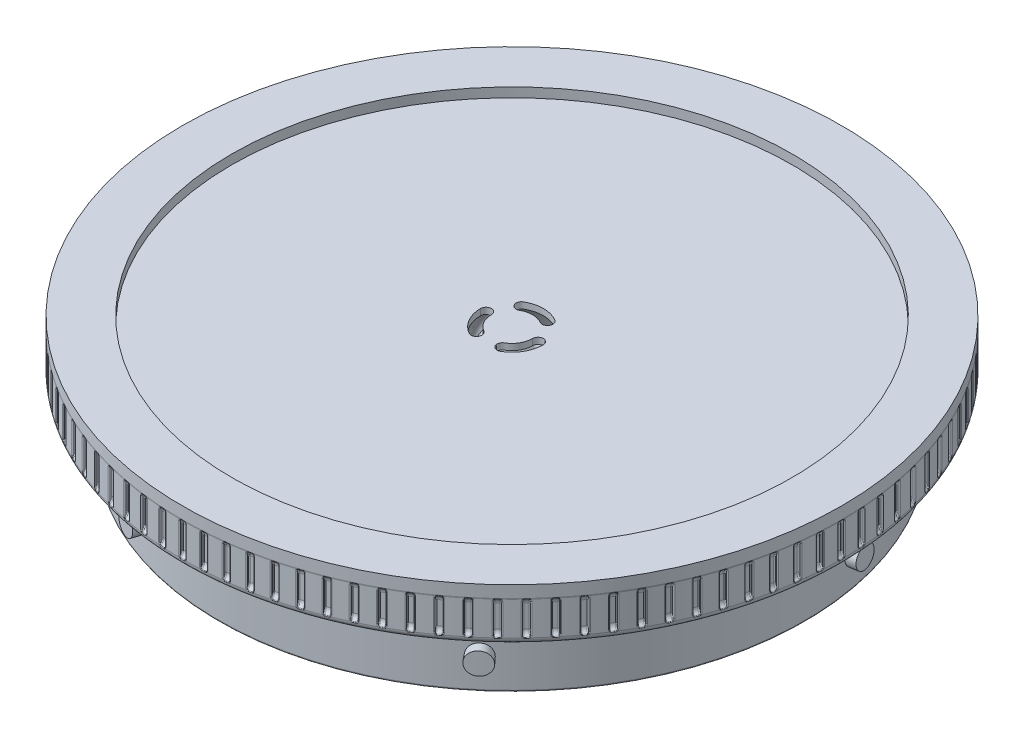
SolidWorks part; units mm, degrees
ref_plane "Front Plane" through (0, 0, 0) normal (0, 0, 1) x (1, 0, 0)
ref_plane "Top Plane" through (0, 0, 0) normal (0, 1, 0) x (1, 0, 0)
ref_plane "Right Plane" through (0, 0, 0) normal (1, 0, 0) x (0, 0, -1)
sketch "Sketch1" plane through (0, 0, 0) normal (0, 0, 1) x (1, 0, 0)
  line L7 (0, 26.2758) -> (0, -19.9258) construction
  line L11 (-38.4313, 0) -> (44.5982, 0) construction
  line L18 (-21.0799, 0.127) -> (-21.0799, 3.556)
  line L19 (-20.5719, 4.064) -> (-1.905, 4.064)
  line L27 (-21.5736, 0) -> (-21.2069, 0)
  line L30 (-23.8125, 6.0452) -> (-26.162, 6.0452)
  line L32 (-22.684, 9.017) -> (0, 9.017)
  line L35 (-22.684, 9.017) -> (-22.684, 9.779)
  line L36 (-22.684, 9.779) -> (-26.162, 9.779)
  line L37 (-26.67, 9.271) -> (-26.67, 6.5532)
  line L38 (0, 3.9624) -> (0, 9.017)
  line L40 (0, 3.9624) -> (-1.905, 3.9624)
  line L41 (-1.905, 3.9624) -> (-1.905, 4.064)
  line L43 (-21.7001, 0.1159) -> (-21.7297, 0.4539)
  line L44 (-21.9827, 0.6858) -> (-23.6093, 0.6858)
  line L45 (-23.7363, 0.8128) -> (-23.7363, 5.969)
  line L46 (-21.8111, 0.6858) -> (-21.8111, 0) construction
  arc A3 (-23.7363, 5.969) -> (-23.8125, 6.0452) centre (-23.8125, 5.969) ccw
  arc A4 (-26.162, 6.0452) -> (-26.67, 6.5532) centre (-26.162, 6.5532) cw
  arc A5 (-21.0799, 0.127) -> (-21.2069, 0) centre (-21.2069, 0.127) cw
  arc A6 (-21.5736, 0) -> (-21.7001, 0.1159) centre (-21.5736, 0.127) cw
  arc A8 (-26.162, 9.779) -> (-26.67, 9.271) centre (-26.162, 9.271) ccw
  arc A9 (-23.6093, 0.6858) -> (-23.7363, 0.8128) centre (-23.6093, 0.8128) cw
  arc A10 (-21.7297, 0.4539) -> (-21.9827, 0.6858) centre (-21.9827, 0.4318) ccw
  arc A11 (-21.0799, 3.556) -> (-20.5719, 4.064) centre (-20.5719, 3.556) cw
  point P18 (-21.3903, 0)
  point P22 (-21.0799, 4.064)
  point P25 (-21.7149, 0.2849)
  point P36 (-21.0799, 0)
  point P39 (-11.2385, 4.064)
  point P40 (-21.8111, 0.6191)
  point P45 (-26.67, 9.779)
  dimension "D8" = 47.4726
  dimension "D18" = 0.508
  dimension "D19" = 0.508
  dimension "D20" = 0.127
  dimension "D3" = 0.0762
  dimension "D13" = 5
  dimension "D17" = 0.127
  dimension "D21" = 0.254
  dimension "D22" = 0.127
  dimension "D23" = 0.508
  dimension "D4" = 4.064
  dimension "D5" = 4.953
  dimension "D6" = 0.6858
  dimension "D7" = 0.635
  dimension "D9" = 3.81
  dimension "D10" = 0.1016
  dimension "D11" = 53.34
  dimension "D12" = 0.762
  dimension "D14" = 2.0066
  dimension "D15" = 45.368
  dimension "D16" = 6.0452
revolve "Revolve1" add sketch "Sketch1" angle 360 about L7
sketch "Sketch6" plane through (0, 0, 0) normal (0, 0, 1) x (1, 0, 0)
  line L0 (0, 14.0933) -> (0, -17.2671) construction
  line L1 (-1.1303, 5.207) -> (-1.524, 5.207)
  line L2 (-1.905, 3.9624) -> (1.905, 3.9624) construction
  line L3 (-1.524, 5.207) -> (-1.524, 7.366)
  line L4 (-1.143, 7.747) -> (0, 7.747)
  line L7 (-1.1303, 4.3815) -> (-1.1303, 5.207)
  line L8 (-1.2954, 4.2164) -> (-1.1303, 4.3815)
  line L9 (-1.2954, 3.9624) -> (-1.2954, 4.2164)
  line L10 (0, 3.9624) -> (0, 7.747)
  line L11 (22.684, 9.017) -> (-22.684, 9.017) construction
  line L13 (-1.2954, 3.9624) -> (0, 3.9624)
  arc A0 (-1.524, 7.366) -> (-1.143, 7.747) centre (-1.143, 7.366) cw
  dimension "D8" = 0.381
  dimension "D1" = 0.254
  dimension "D2" = 2.5908
  dimension "D3" = 2.2606
  dimension "D4" = 1.2446
  dimension "D5" = 135
  dimension "D6" = 3.048
  dimension "D7" = 1.27
revolve "Cut-Revolve1" cut sketch "Sketch6" angle 360 about L0
fillet "Fillet2" radius 0.1524 1 edges at (0, 3.9624, 1.2954)
sketch "Sketch17" plane through (0, 0, 0) normal (0, 0, 1) x (1, 0, 0)
  line L0 (0, 21.9284) -> (0, -19.7948) construction
  line L1 (-12.7, 1.0668) -> (12.7, 1.0668) construction
  line L2 (-23.6093, 0.6858) -> (23.6093, 0.6858) construction
  text T0 "SP007FL" font "Century Gothic" height in points 6
  point P5 (0, 1.0668)
  dimension "D1" = 0.381
  dimension "D2" = 12.7
wrap "Wrap6" sketch "Sketch17" wrap type deboss source sketch "Sketch17" thickness 0.508 parameters "D1"=0.508
sketch "Sketch9" plane through (0, 0, 0) normal (0, 0, 1) x (1, 0, 0)
  line L3 (26.67, 9.271) -> (26.67, 6.5532)
  line L4 (0, 21.7779) -> (0, -14.6441) construction
  line L5 (-26.67, 6.5532) -> (26.67, 6.5532) construction
  line L6 (-26.67, 9.271) -> (26.67, 9.271) construction
  line L7 (26.416, 8.8311) -> (26.416, 6.9931)
  arc A2 (26.416, 6.9931) -> (26.67, 6.5532) centre (26.924, 6.9931) ccw
  arc A3 (26.67, 9.271) -> (26.416, 8.8311) centre (26.924, 8.8311) ccw
  dimension "D1" = 0.254
revolve "Knurls" cut sketch "Sketch9" angle 1 mid plane about L4
sketch "Sketch11" plane through (0, 9.017, 0) normal (0, 1, 0) x (1, 0, 0)
  circle A0 centre (0, 0) radius 22.684
  circle A1 centre (0, 0) radius 22.684 construction
sketch "Sketch12" plane through (0, 9.779, 0) normal (0, 1, 0) x (1, 0, 0)
  circle A0 centre (0, 0) radius 26.67
  circle A1 centre (0, 0) radius 26.67 construction
  circle A2 centre (0, 0) radius 22.684
  circle A3 centre (0, 0) radius 22.684 construction
fillet "Fillet - Knurl" radius 0.0762 10 edges at (26.669, 7.9121, 0.2327) (26.669, 7.9121, -0.2327) (26.415, 7.9121, 0.2305) (26.415, 7.9121, -0.2305) (26.4831, 9.0851, 0.2311) (26.4831, 9.0851, -0.2311) (26.4831, 6.7391, 0.2311) (26.4831, 6.7391, -0.2311) (26.67, 6.5532, 0) (26.67, 9.271, 0)
pattern_circular "CirPattern2" count 100 over 360 about axis through (0, 6.5532, 0) along (0, 1, 0) of "Knurls", "Fillet - Knurl"
sketch "Sketch4" plane through (0, 4.064, 0) normal (0, 1, 0) x (1, 0, 0)
  line L0 (0, 7.9602) -> (0, -9.8695) construction
  line L1 (-13.1456, 0) -> (14.4693, 0) construction
  line L2 (0, 0) -> (1.858, -3.2182) construction
  line L3 (0, 0) -> (-1.858, -3.2182) construction
  arc A1 (4.1529, 0) -> (3.2791, 0) centre (3.716, 0) ccw construction
  arc A2 (1.6396, -2.8398) -> (2.0764, -3.5965) centre (1.858, -3.2182) ccw construction
  arc A3 (4.1529, 0) -> (2.0764, -3.5965) centre (0, 0) cw construction
  arc A4 (3.2791, 0) -> (1.6396, -2.8398) centre (0, 0) cw construction
  arc A5 (-2.0765, -3.5965) -> (-1.6396, -2.8398) centre (-1.858, -3.2182) ccw
  arc A6 (-1.6396, -2.8398) -> (-3.2791, 0) centre (0, 0) cw
  arc A7 (-3.2791, 0) -> (-4.1529, 0) centre (-3.716, 0) ccw
  arc A8 (-2.0765, -3.5965) -> (-4.1529, 0) centre (0, 0) cw
  arc A9 (-2.0764, 3.5965) -> (-1.6396, 2.8398) centre (-1.858, 3.2182) ccw construction
  arc A10 (-1.6396, 2.8398) -> (1.6396, 2.8398) centre (0, 0) cw construction
  arc A11 (1.6396, 2.8398) -> (2.0765, 3.5965) centre (1.858, 3.2182) ccw construction
  arc A12 (-2.0764, 3.5965) -> (2.0765, 3.5965) centre (0, 0) cw construction
  circle A15 centre (0, 0) radius 4.1529 construction
  circle A16 centre (0, 0) radius 1.905 construction
  point P31 (0, 0)
  dimension "D1" = 8.3058
  dimension "D3" = 0.4369
  dimension "D2" = 60
  dimension "D4" = 60
sketch "Sketch14" plane through (0, 9.017, 0) normal (0, 1, 0) x (1, 0, 0)
  line L0 (0, 0) -> (-2.54, 0) construction
  line L1 (0, 0) -> (-1.27, -2.1997) construction
  arc A1 (-1.27, 2.1997) -> (-0.8331, 1.443) centre (-1.0516, 1.8214) ccw construction
  arc A2 (0.8331, 1.443) -> (-0.8331, 1.443) centre (0, 0) ccw construction
  arc A3 (0.8331, 1.443) -> (1.27, 2.1997) centre (1.0516, 1.8214) ccw construction
  arc A4 (1.27, 2.1997) -> (-1.27, 2.1997) centre (0, 0) ccw construction
  arc A5 (2.54, 0) -> (1.6662, 0) centre (2.1031, 0) ccw construction
  arc A6 (0.8331, -1.443) -> (1.6662, 0) centre (0, 0) ccw construction
  arc A7 (0.8331, -1.443) -> (1.27, -2.1997) centre (1.0516, -1.8214) ccw construction
  arc A8 (1.27, -2.1997) -> (2.54, 0) centre (0, 0) ccw construction
  circle A9 centre (0, 0) radius 2.54 construction
  arc A24 (-1.27, -2.1997) -> (-0.8331, -1.443) centre (-1.0516, -1.8214) ccw
  arc A25 (-2.54, 0) -> (-1.27, -2.1997) centre (0, 0) ccw
  arc A26 (-1.6662, 0) -> (-2.54, 0) centre (-2.1031, 0) ccw
  arc A27 (-1.6662, 0) -> (-0.8331, -1.443) centre (0, 0) ccw
  point P17 (0, 0)
  point P19 (0, 0)
  dimension "D1" = 0.8738
  dimension "D2" = 60
  dimension "D4" = 5.08
  dimension "D3" = 3
sketch "Sketch15" plane through (0, 0, 0) normal (0, 0, 1) x (1, 0, 0)
  arc A0 (-2.54, 9.017) -> (-4.1529, 4.064) centre (4.2586, 4.064) ccw
loft "Cut-Loft2" cut profiles "Sketch4", "Sketch14"
pattern_circular "CirPattern3" count 3 over 360 about axis through (0, 9.779, 0) along (0, 1, 0) of "Cut-Loft2"
fillet "Fillet9" radius 0.127 8 edges
fillet "Fillet10" radius 0.254 1 edges at (-22.684, 9.779, 0)
sketch "Sketch16" plane through (0, 0, 0) normal (0, 0, 1) x (1, 0, 0)
  circle A0 centre (-7.8994, 3.195) radius 0.889
  point P2 (-7.8994, 2.306)
  point P6 (-7.8994, 4.084)
  dimension "D1" = 1.778
  dimension "D2" = 4.084
  dimension "D3" = 7.8994
wrap "Wrap1" sketch "Sketch16" wrap type emboss source sketch "Sketch16" thickness 0.7874 parameters "D1"=0.7874
pattern_circular "CirPattern4" count 6 over 360 about axis through (0, 26.2758, 0) along (0, 1, 0) of "Wrap1"
sketch "Sketch18" plane through (0, 9.017, 0) normal (0, 1, 0) x (1, 0, 0)
  circle A29 centre (0, 0) radius 22.684
  circle A30 centre (0, 0) radius 22.684
  arc A31 (-2.54, 0) -> (-1.27, -2.1997) centre (0, 0) ccw
  arc A32 (-1.27, -2.1997) -> (-0.8331, -1.443) centre (-1.0516, -1.8214) ccw
  arc A33 (-1.6662, 0) -> (-2.54, 0) centre (-2.1031, 0) ccw
  arc A34 (-1.6662, 0) -> (-0.8331, -1.443) centre (0, 0) ccw
  arc A35 (-2.54, 0) -> (-1.27, -2.1997) centre (0, 0) ccw
  arc A36 (-1.27, -2.1997) -> (-0.8331, -1.443) centre (-1.0516, -1.8214) ccw
  arc A37 (-1.6662, 0) -> (-2.54, 0) centre (-2.1031, 0) ccw
  arc A38 (-1.6662, 0) -> (-0.8331, -1.443) centre (0, 0) ccw
  spline S24 degree 3 poles (-808.9626, -2885.6027) (21.4143, -145.0855) (15.4675, 0.6215) (0, 2.567) (-0.6426, 2.4861) (-1.0637, 2.3188) (-1.3124, 2.1753) (-1.3934, 2.1094) (-1.479, 1.9589) (-1.4996, 1.7724) (-1.4371, 1.5871) (-1.3028, 1.4479) (-1.1334, 1.3807) (4.2577, 1.4649) (-31.4982, 81.4698) (-1424.8174, -2637.9466) knots -6.792038 -6.792038 -6.792038 -6.792038 0.098139 0.196278 0.294417 0.392556 0.392556 0.412701 0.432847 0.452993 0.473139 0.493285 0.513431 0.533576 2.450846 2.450846 2.450846 2.450846 only from (1.27, 2.1997) to (-0.8331, 1.443)
  spline S25 degree 3 poles (-807.4511, -2888.0406) (-21.7971, -71.5987) (-8.6993, 0.6109) (0, 1.6832) (0.4108, 1.6326) (0.6894, 1.526) (0.8737, 1.4196) (0.9669, 1.3833) (1.1334, 1.3807) (1.3028, 1.4479) (1.4371, 1.5871) (1.4996, 1.7724) (1.479, 1.9589) (-1.1881, 6.6441) (-54.8624, -62.3296) (2999.1342, -84.9743) knots -3.760137 -3.760137 -3.760137 -3.760137 0.625 0.696278 0.767556 0.838833 0.838833 0.858979 0.879125 0.899271 0.919417 0.939563 0.959708 0.979854 2.82129 2.82129 2.82129 2.82129 only from (-0.8331, 1.443) to (1.27, 2.1997)
  spline S26 degree 3 poles (1.27, 2.1997) (1.0637, 2.3188) (0.6426, 2.4861) (0, 2.567) (-0.6426, 2.4861) (-1.0637, 2.3188) (-1.3124, 2.1753) (-1.3934, 2.1094) (-1.479, 1.9589) (-1.4996, 1.7724) (-1.4371, 1.5871) (-1.3028, 1.4479) (-1.1334, 1.3807) (-0.9669, 1.3833) (-0.8737, 1.4196) (-0.8331, 1.443) knots 0 0 0 0 0.098139 0.196278 0.294417 0.392556 0.392556 0.412701 0.432847 0.452993 0.473139 0.493285 0.513431 0.533576 0.553722 0.553722 0.553722 0.553722
  spline S27 degree 3 poles (-0.8331, 1.443) (-0.6894, 1.526) (-0.4108, 1.6326) (0, 1.6832) (0.4108, 1.6326) (0.6894, 1.526) (0.8737, 1.4196) (0.9669, 1.3833) (1.1334, 1.3807) (1.3028, 1.4479) (1.4371, 1.5871) (1.4996, 1.7724) (1.479, 1.9589) (1.3934, 2.1094) (1.3124, 2.1753) (1.27, 2.1997) knots 0.553722 0.553722 0.553722 0.553722 0.625 0.696278 0.767556 0.838833 0.838833 0.858979 0.879125 0.899271 0.919417 0.939563 0.959708 0.979854 1 1 1 1
  spline S30 degree 3 poles (-2097.391, 2143.2935) (-51.1078, 54.6762) (4.8787, 7.2283) (1.4577, -0.8416) (1.2084, -1.1721) (0.9769, -1.36) (0.7925, -1.4665) (0.7145, -1.529) (0.629, -1.6719) (0.6025, -1.8522) (0.6559, -2.0381) (0.7851, -2.1849) (0.957, -2.2603) (6.348, -2.2931) (-26.5478, 78.677) (-1573.157, -2554.8393) knots -3.760137 -3.760137 -3.760137 -3.760137 0.625 0.696278 0.767556 0.838833 0.838833 0.858979 0.879125 0.899271 0.919417 0.939563 0.959708 0.979854 2.82129 2.82129 2.82129 2.82129 only from (1.6662, 0) to (1.27, -2.1997)
  spline S31 degree 3 poles (-2094.524, 2143.3835) (-136.3549, 53.9975) (-7.1955, -13.706) (2.223, -1.2835) (2.4744, -0.6865) (2.54, -0.2382) (2.54, 0.0489) (2.5235, 0.152) (2.436, 0.3014) (2.2847, 0.4125) (2.093, 0.451) (1.9053, 0.4043) (1.7624, 0.2912) (-0.8602, -4.4198) (86.304, -13.4567) (-1572.1201, 2552.9014) knots -6.792038 -6.792038 -6.792038 -6.792038 0.098139 0.196278 0.294417 0.392556 0.392556 0.412701 0.432847 0.452993 0.473139 0.493285 0.513431 0.533576 2.450846 2.450846 2.450846 2.450846 only from (1.27, -2.1997) to (1.6662, 0)
  spline S32 degree 3 poles (1.6662, 0) (1.6662, -0.166) (1.6193, -0.4605) (1.4577, -0.8416) (1.2084, -1.1721) (0.9769, -1.36) (0.7925, -1.4665) (0.7145, -1.529) (0.629, -1.6719) (0.6025, -1.8522) (0.6559, -2.0381) (0.7851, -2.1849) (0.957, -2.2603) (1.1301, -2.2614) (1.2276, -2.2242) (1.27, -2.1997) knots 0.553722 0.553722 0.553722 0.553722 0.625 0.696278 0.767556 0.838833 0.838833 0.858979 0.879125 0.899271 0.919417 0.939563 0.959708 0.979854 1 1 1 1
  spline S33 degree 3 poles (1.27, -2.1997) (1.4763, -2.0806) (1.8317, -1.7996) (2.223, -1.2835) (2.4744, -0.6865) (2.54, -0.2382) (2.54, 0.0489) (2.5235, 0.152) (2.436, 0.3014) (2.2847, 0.4125) (2.093, 0.451) (1.9053, 0.4043) (1.7624, 0.2912) (1.6814, 0.1458) (1.6662, 0.0469) (1.6662, 0) knots 0 0 0 0 0.098139 0.196278 0.294417 0.392556 0.392556 0.412701 0.432847 0.452993 0.473139 0.493285 0.513431 0.533576 0.553722 0.553722 0.553722 0.553722
  dimension "D1" = 0
  dimension "D2" = 0
  dimension "D3" = 0
  dimension "D4" = 0
extrude "Boss-Extrude1" [suppressed] add sketch "Sketch18" along normal blind 0.508
sketch "Sketch19" [suppressed] plane through (0, 9.525, 0) normal (0, 1, 0) x (1, 0, 0)
  circle A1 centre (0, 0) radius 22.684
  circle A2 centre (0, 0) radius 22.684 construction
  circle A3 centre (0, 0) radius 26.67
  arc A4 (-26.632, 1.4223) -> (-26.6688, 0.2528) centre (0, 0) ccw construction
extrude "Boss-Extrude2" [suppressed] add sketch "Sketch19" along normal blind 0.508 and the other way up to vertex
sketch "Sketch20" plane through (0, 9.017, 0) normal (0, 1, 0) x (1, 0, 0)
  circle A0 centre (0, 0) radius 22.684
  circle A1 centre (0, 0) radius 22.684 construction
  arc A10 (-2.54, 0) -> (-1.27, -2.1997) centre (0, 0) ccw
  arc A11 (-1.27, -2.1997) -> (-0.8331, -1.443) centre (-1.0516, -1.8214) ccw
  arc A12 (-1.6662, 0) -> (-0.8331, -1.443) centre (0, 0) ccw
  arc A13 (-1.6662, 0) -> (-2.54, 0) centre (-2.1031, 0) ccw
  arc A14 (-2.54, 0) -> (-1.27, -2.1997) centre (0, 0) ccw
  arc A15 (-1.27, -2.1997) -> (-0.8331, -1.443) centre (-1.0516, -1.8214) ccw
  arc A16 (-1.6662, 0) -> (-0.8331, -1.443) centre (0, 0) ccw
  arc A17 (-1.6662, 0) -> (-2.54, 0) centre (-2.1031, 0) ccw
  spline S4 degree 3 poles (-2797.0186, 2857.7333) (-63.0964, 64.725) (5.2208, 8.0353) (1.4577, -0.8416) (1.2084, -1.1721) (0.9769, -1.36) (0.7925, -1.4665) (0.7145, -1.529) (0.629, -1.6719) (0.6025, -1.8522) (0.6559, -2.0381) (0.7851, -2.1849) (0.957, -2.2603) (6.8695, -2.2963) (-33.3469, 95.2871) (-2077.6468, -3418.11) knots -4.212891 -4.212891 -4.212891 -4.212891 0.625 0.696278 0.767556 0.838833 0.838833 0.858979 0.879125 0.899271 0.919417 0.939563 0.959708 0.979854 3.003327 3.003327 3.003327 3.003327 only from (1.6662, 0) to (1.27, -2.1997)
  spline S5 degree 3 poles (-2777.1211, 2874.1634) (-164.5096, 68.9408) (-8.1612, -14.9798) (2.223, -1.2835) (2.4744, -0.6865) (2.54, -0.2382) (2.54, 0.0489) (2.5235, 0.152) (2.436, 0.3014) (2.2847, 0.4125) (2.093, 0.451) (1.9053, 0.4043) (1.7624, 0.2912) (-1.114, -4.8756) (104.2062, -15.2656) (-2116.5257, 3391.4576) knots -7.518652 -7.518652 -7.518652 -7.518652 0.098139 0.196278 0.294417 0.392556 0.392556 0.412701 0.432847 0.452993 0.473139 0.493285 0.513431 0.533576 2.640269 2.640269 2.640269 2.640269 only from (1.27, -2.1997) to (1.6662, 0)
  spline S6 degree 3 poles (1.6662, 0) (1.6662, -0.166) (1.6193, -0.4605) (1.4577, -0.8416) (1.2084, -1.1721) (0.9769, -1.36) (0.7925, -1.4665) (0.7145, -1.529) (0.629, -1.6719) (0.6025, -1.8522) (0.6559, -2.0381) (0.7851, -2.1849) (0.957, -2.2603) (1.1301, -2.2614) (1.2276, -2.2242) (1.27, -2.1997) knots 0.553722 0.553722 0.553722 0.553722 0.625 0.696278 0.767556 0.838833 0.838833 0.858979 0.879125 0.899271 0.919417 0.939563 0.959708 0.979854 1 1 1 1
  spline S7 degree 3 poles (1.27, -2.1997) (1.4763, -2.0806) (1.8317, -1.7996) (2.223, -1.2835) (2.4744, -0.6865) (2.54, -0.2382) (2.54, 0.0489) (2.5235, 0.152) (2.436, 0.3014) (2.2847, 0.4125) (2.093, 0.451) (1.9053, 0.4043) (1.7624, 0.2912) (1.6814, 0.1458) (1.6662, 0.0469) (1.6662, 0) knots 0 0 0 0 0.098139 0.196278 0.294417 0.392556 0.392556 0.412701 0.432847 0.452993 0.473139 0.493285 0.513431 0.533576 0.553722 0.553722 0.553722 0.553722
  spline S10 degree 3 poles (-1076.3604, -3851.1558) (-24.5052, -87.0056) (-9.5692, 0.5037) (0, 1.6832) (0.4108, 1.6326) (0.6894, 1.526) (0.8737, 1.4196) (0.9669, 1.3833) (1.1334, 1.3807) (1.3028, 1.4479) (1.4371, 1.5871) (1.4996, 1.7724) (1.479, 1.9589) (-1.4461, 7.0973) (-65.8476, -76.5228) (3998.9935, -90.24) knots -4.212891 -4.212891 -4.212891 -4.212891 0.625 0.696278 0.767556 0.838833 0.838833 0.858979 0.879125 0.899271 0.919417 0.939563 0.959708 0.979854 3.003327 3.003327 3.003327 3.003327 only from (-0.8331, 1.443) to (1.27, 2.1997)
  spline S11 degree 3 poles (-1100.538, -3842.1391) (22.5503, -176.9399) (17.0535, 0.422) (0, 2.567) (-0.6426, 2.4861) (-1.0637, 2.3188) (-1.3124, 2.1753) (-1.3934, 2.1094) (-1.479, 1.9589) (-1.4996, 1.7724) (-1.4371, 1.5871) (-1.3028, 1.4479) (-1.1334, 1.3807) (4.7794, 1.4731) (-38.8827, 97.8781) (-1878.8256, -3528.6938) knots -7.518652 -7.518652 -7.518652 -7.518652 0.098139 0.196278 0.294417 0.392556 0.392556 0.412701 0.432847 0.452993 0.473139 0.493285 0.513431 0.533576 2.640269 2.640269 2.640269 2.640269 only from (1.27, 2.1997) to (-0.8331, 1.443)
  spline S12 degree 3 poles (-0.8331, 1.443) (-0.6894, 1.526) (-0.4108, 1.6326) (0, 1.6832) (0.4108, 1.6326) (0.6894, 1.526) (0.8737, 1.4196) (0.9669, 1.3833) (1.1334, 1.3807) (1.3028, 1.4479) (1.4371, 1.5871) (1.4996, 1.7724) (1.479, 1.9589) (1.3934, 2.1094) (1.3124, 2.1753) (1.27, 2.1997) knots 0.553722 0.553722 0.553722 0.553722 0.625 0.696278 0.767556 0.838833 0.838833 0.858979 0.879125 0.899271 0.919417 0.939563 0.959708 0.979854 1 1 1 1
  spline S13 degree 3 poles (1.27, 2.1997) (1.0637, 2.3188) (0.6426, 2.4861) (0, 2.567) (-0.6426, 2.4861) (-1.0637, 2.3188) (-1.3124, 2.1753) (-1.3934, 2.1094) (-1.479, 1.9589) (-1.4996, 1.7724) (-1.4371, 1.5871) (-1.3028, 1.4479) (-1.1334, 1.3807) (-0.9669, 1.3833) (-0.8737, 1.4196) (-0.8331, 1.443) knots 0 0 0 0 0.098139 0.196278 0.294417 0.392556 0.392556 0.412701 0.432847 0.452993 0.473139 0.493285 0.513431 0.533576 0.553722 0.553722 0.553722 0.553722
  dimension "D1" = 0
  dimension "D2" = 0
  dimension "D3" = 0
extrude "Boss-Extrude3" add sketch "Sketch20" along normal blind 0.508
sketch "Sketch21" plane through (0, 9.779, 0) normal (0, 1, 0) x (1, 0, 0)
  circle A0 centre (0, 0) radius 22.684
  circle A1 centre (0, 0) radius 22.684 construction
  circle A2 centre (0, 0) radius 26.67
  arc A3 (13.0693, -23.2483) -> (14.0764, -22.6527) centre (0, 0) ccw construction
extrude "Boss-Extrude4" add sketch "Sketch21" along normal blind 0.508 and the other way up to vertex
